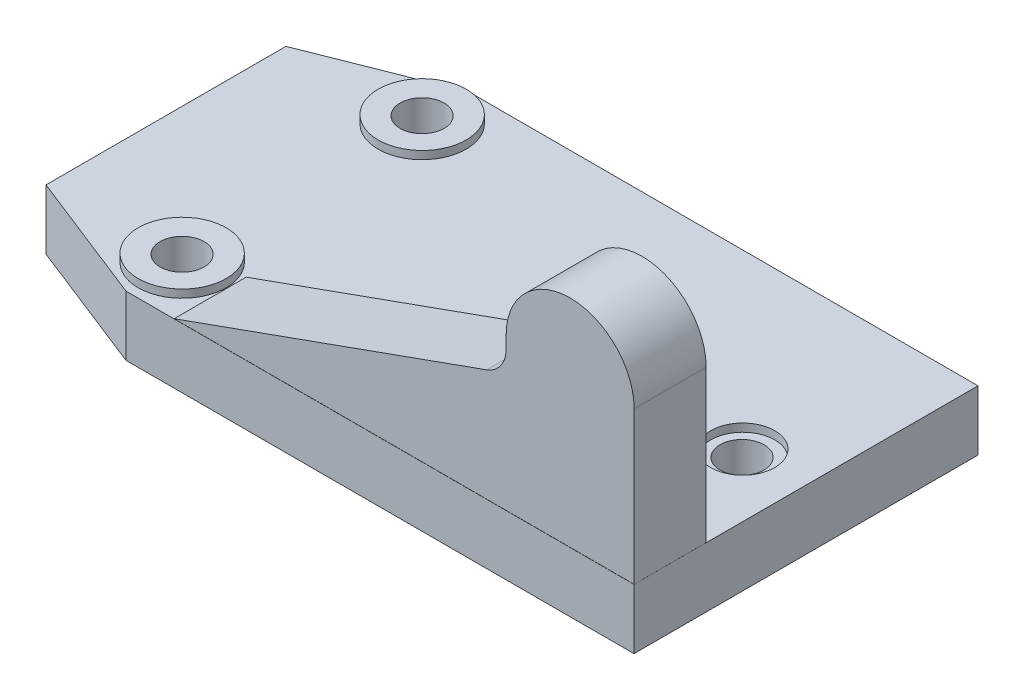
SolidWorks part; units mm, degrees
ref_plane "Face" through (0, 0, 0) normal (0, 0, 1) x (1, 0, 0)
ref_plane "Dessus" through (0, 0, 0) normal (0, 1, 0) x (1, 0, 0)
ref_plane "Droite" through (0, 0, 0) normal (1, 0, 0) x (0, 0, -1)
sketch "Esquisse2" plane through (0, 0, 0) normal (0, 1, 0) x (1, 0, 0)
  line L0 (0, 0) -> (0, 86)
  line L1 (0, 86) -> (-127, 86)
  line L2 (-127, 86) -> (-160, 73)
  line L3 (-160, 73) -> (-160, 13)
  line L4 (-160, 13) -> (-127, 0)
  line L5 (-127, 0) -> (0, 0)
  dimension "D1" = 160
  dimension "D2" = 86
  dimension "D3" = 127
  dimension "D4" = 127
  dimension "D5" = 13
  dimension "D6" = 13
extrude "Extrusion1" add sketch "Esquisse2" along normal blind 15
sketch "Esquisse4" plane through (-253.1986, 15, -86.2444) normal (0, 1, 0) x (-1, 0, 0)
  circle A0 centre (-127, 73) radius 11
  circle A1 centre (-127, 13) radius 11
  dimension "D1" = 22
  dimension "D2" = 22
extrude "Extrusion3" add sketch "Esquisse4" along normal blind 2
sketch "Esquisse8" plane through (1.0378, 17, 0.0139) normal (0, 1, 0) x (1, 0, 0)
  line L2 (-1.0378, 86.0139) -> (-128.0378, 86.0139) construction
  line L3 (-1.0378, 0.0139) -> (-1.0378, 86.0139) construction
  circle A0 centre (-127, 73) radius 5.5
  circle A1 centre (-127, 13) radius 5.5
  circle A2 centre (-17.0378, 43.0139) radius 5.5
  dimension "D3" = 11
  dimension "D4" = 11
  dimension "D5" = 11
  dimension "D1" = 43
  dimension "D2" = 16
extrude "Enlèv. mat.-Extru.4" cut sketch "Esquisse8" against normal through all
sketch "Esquisse9" plane through (-31.6991, 15, -85.8826) normal (0, 1, 0) x (-1, 0, 0)
  circle A0 centre (-16, 43) radius 8
  dimension "D1" = 16
extrude "Enlèv. mat.-Extru.5" cut sketch "Esquisse9" against normal blind 2
sketch "Esquisse10" plane through (0.0338, 0.0417, 0) normal (0, 0, -1) x (1, 0, 0)
  line L0 (0, -15) -> (0, -53)
  line L1 (-32, -53) -> (-32, -49.9121)
  line L2 (-115, -15) -> (-36.8655, -43)
  line L5 (-115, -15) -> (0, -15)
  arc A0 (0, -53) -> (-32, -53) centre (-16, -53) cw
  arc A1 (-32, -49.9121) -> (-36.8655, -43) centre (-39.3425, -49.9121) ccw
  dimension "D5" = 28
  dimension "D1" = 16
  dimension "D2" = 38
  dimension "D3" = 115
  dimension "D4" = 83
extrude "Extrusion4" add sketch "Esquisse10" along normal blind 18
